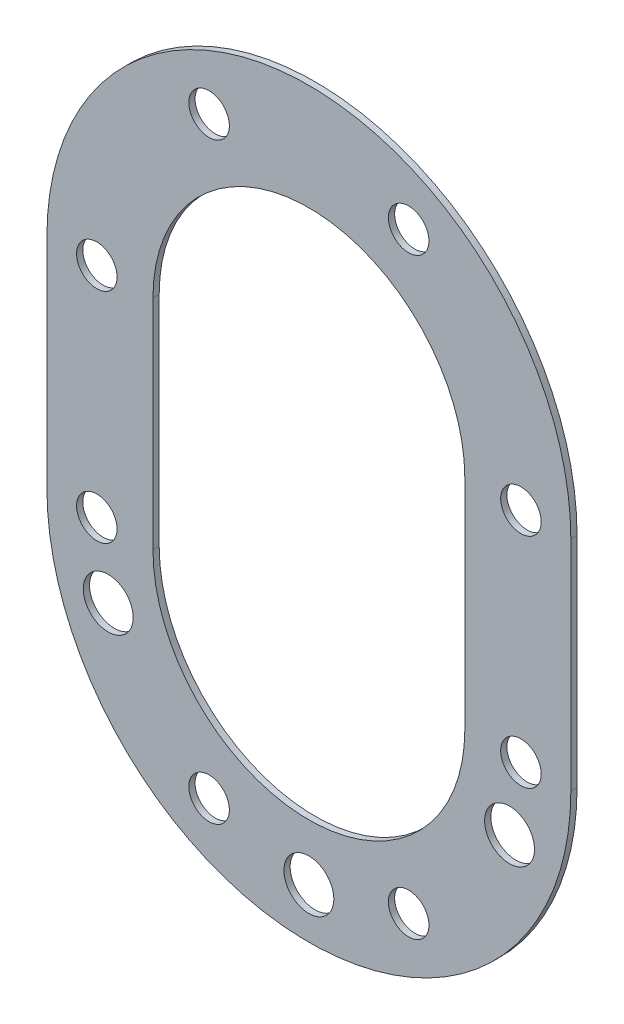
SolidWorks part; units mm, degrees
ref_plane "正面" through (0, 0, 0) normal (0, 0, 1) x (1, 0, 0)
ref_plane "平面" through (0, 0, 0) normal (0, 1, 0) x (1, 0, 0)
ref_plane "右側面" through (0, 0, 0) normal (1, 0, 0) x (0, 0, -1)
sketch "s-歯車軸レイアウト" plane through (0, 0, 0) normal (0, 0, 1) x (1, 0, 0)
  line L0 (0, 0) -> (0, -35) construction
  circle A0 centre (0, 0) radius 10.4
  circle A1 centre (0, -35) radius 10.4
  dimension "D1" = 20.8
  dimension "D2" = 35
sketch "s-パッキン外形" plane through (0, 0, 0) normal (0, 0, 1) x (1, 0, 0)
  circle A0 centre (0, 0) radius 42
  circle A1 centre (0, -35) radius 42
  dimension "D1" = 84
  dimension "D2" = 119
sketch "s-パッキン内形" plane through (0, 0, 0) normal (0, 0, 1) x (1, 0, 0)
  circle A0 centre (0, 0) radius 25
  circle A1 centre (0, -35) radius 25
  dimension "D1" = 50
sketch "s-穴位置1" plane through (0, 0, 0) normal (0, 0, 1) x (1, 0, 0)
  circle A0 centre (0, 0) radius 34
  circle A1 centre (0, -35) radius 34
  dimension "D1" = 68
sketch "s-穴位置2" plane through (0, 0, 0) normal (0, 0, 1) x (1, 0, 0)
  line L0 (-34, 0) -> (-34, -35)
  line L1 (34, 0) -> (34, -35)
  line L2 (-16, -65) -> (-16, 30) construction
  line L3 (16, 30) -> (16, -65) construction
  circle A0 centre (0, 0) radius 34 construction
  circle A1 centre (0, -35) radius 34 construction
  arc A2 (34, 0) -> (-34, 0) centre (0, 0) ccw
  arc A3 (-34, -35) -> (34, -35) centre (0, -35) ccw
  point P4 (16, 30)
  point P5 (16, -65)
  point P10 (-16, -65)
  point P11 (-34, -35)
  point P12 (-34, 0)
  point P13 (34, 0)
  point P14 (34, -35)
  dimension "D1" = 16
  dimension "D2" = 16
sketch "s-穴位置3" plane through (0, 0, 0) normal (0, 0, 1) x (1, 0, 0)
  line L0 (0, -35) -> (0, -69) construction
  line L1 (-32.1714, -46) -> (32.1714, -46) construction
  circle A0 centre (0, -35) radius 34 construction
  dimension "D1" = 11
sketch "ｽｹｯﾁ7" plane through (0, 0, 0) normal (0, 0, 1) x (1, 0, 0)
  line L0 (-42, 0) -> (-42, -35)
  line L1 (42, 0) -> (42, -35)
  circle A0 centre (0, 0) radius 42 construction
  circle A1 centre (0, -35) radius 42 construction
  arc A2 (42, 0) -> (-42, 0) centre (0, 0) ccw
  arc A3 (-42, -35) -> (42, -35) centre (0, -35) ccw
extrude "ﾎﾞｽ - 押し出し1" add sketch "ｽｹｯﾁ7" along normal blind 1
sketch "ｽｹｯﾁ8" plane through (0, 0, 0) normal (0, 0, 1) x (1, 0, 0)
  line L0 (-25, 0) -> (-25, -35)
  line L1 (25, 0) -> (25, -35)
  circle A0 centre (0, 0) radius 25 construction
  circle A1 centre (0, -35) radius 25 construction
  arc A2 (25, 0) -> (-25, 0) centre (0, 0) ccw
  arc A3 (-25, -35) -> (25, -35) centre (0, -35) ccw
extrude "ｶｯﾄ - 押し出し1" cut sketch "ｽｹｯﾁ8" along normal through all
sketch "ｽｹｯﾁ10" plane through (0, 0, 0) normal (0, 0, 1) x (1, 0, 0)
  circle A0 centre (-16, 30) radius 3.25
  dimension "D1" = 6.5
extrude "ｶｯﾄ - 押し出し2" cut sketch "ｽｹｯﾁ10" along normal through all
pattern_sketch "ｽｹｯﾁ-ﾊﾟﾀｰﾝ1" of "ｶｯﾄ - 押し出し2"
sketch "ｽｹｯﾁ11" plane through (0, 0, 0) normal (0, 0, 1) x (1, 0, 0)
  circle A0 centre (-32.1714, -46) radius 4
  circle A1 centre (0, -69) radius 4
  circle A2 centre (32.1714, -46) radius 4
  dimension "D1" = 8
extrude "ｶｯﾄ - 押し出し3" cut sketch "ｽｹｯﾁ11" along normal through all
